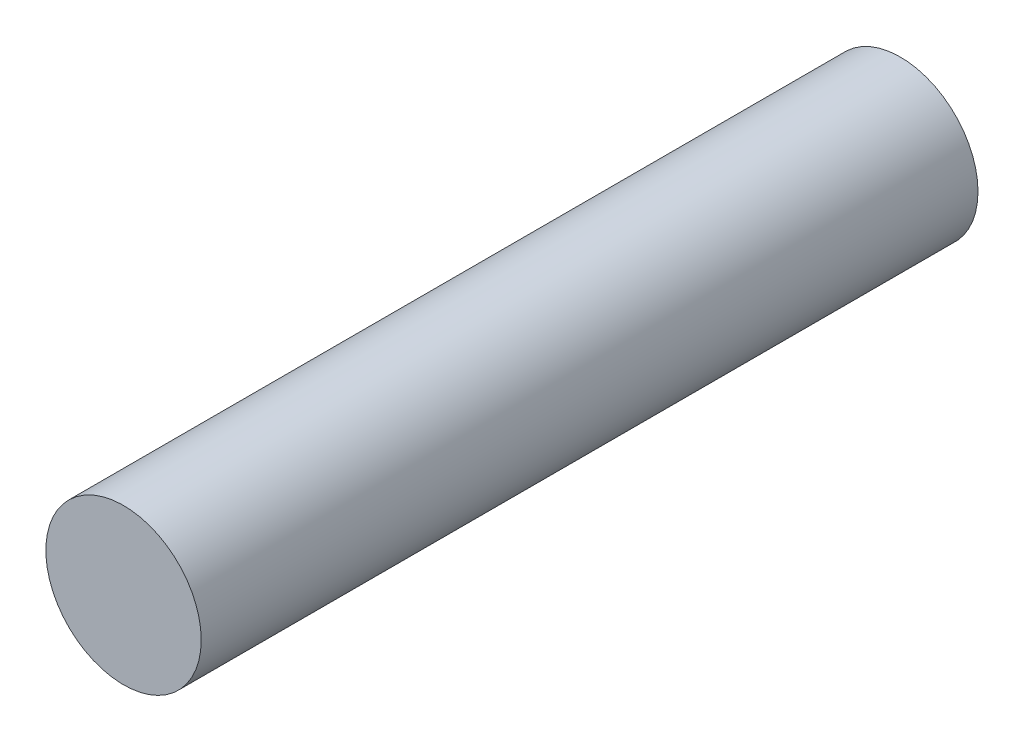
SolidWorks part; units mm, degrees
ref_plane "Front Plane" through (0, 0, 0) normal (0, 0, 1) x (1, 0, 0)
ref_plane "Top Plane" through (0, 0, 0) normal (0, 1, 0) x (1, 0, 0)
ref_plane "Right Plane" through (0, 0, 0) normal (1, 0, 0) x (0, 0, -1)
sketch "Sketch1" plane through (0, 0, 0) normal (0, 0, 1) x (1, 0, 0)
  circle A0 centre (0, 0) radius 2.5
  dimension "D1" = 5
extrude "Boss-Extrude1" add sketch "Sketch1" along normal blind 25
